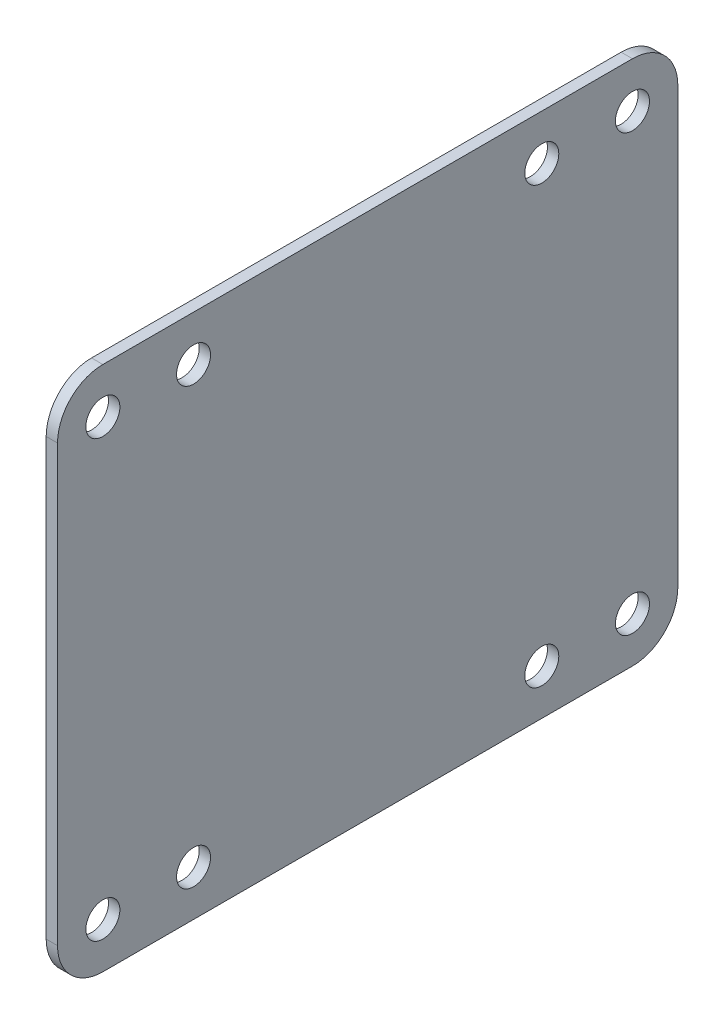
SolidWorks part; units mm, degrees
ref_plane "Front Plane" through (0, 0, 0) normal (0, 0, 1) x (1, 0, 0)
ref_plane "Top Plane" through (0, 0, 0) normal (0, 1, 0) x (1, 0, 0)
ref_plane "Right Plane" through (0, 0, 0) normal (1, 0, 0) x (0, 0, -1)
sketch "Sketch1" plane through (0, 0, 0) normal (1, 0, 0) x (0, 0, -1)
  line L0 (-12.7, 0) -> (61.468, 0) construction
  line L1 (0, 0) -> (48.768, 0) construction
  line L2 (0, 0) -> (0, -60.96) construction
  line L3 (0, -60.96) -> (48.768, -60.96) construction
  line L4 (48.768, 0) -> (48.768, -60.96) construction
  line L5 (-19.05, 6.35) -> (67.818, 6.35)
  line L6 (-19.05, 6.35) -> (-19.05, -67.31)
  line L7 (-19.05, -67.31) -> (67.818, -67.31)
  line L8 (67.818, 6.35) -> (67.818, -67.31)
  line L9 (-12.7, 0) -> (-12.7, -60.96) construction
  line L10 (-12.7, -60.96) -> (61.468, -60.96) construction
  line L11 (61.468, 0) -> (61.468, -60.96) construction
  circle A0 centre (0, 0) radius 2.3813
  circle A1 centre (48.768, 0) radius 2.3812
  circle A2 centre (48.768, -60.96) radius 2.3812
  circle A3 centre (0, -60.96) radius 2.3812
  circle A4 centre (-12.7, 0) radius 2.3813
  circle A5 centre (61.468, 0) radius 2.3812
  circle A6 centre (61.468, -60.96) radius 2.3813
  circle A7 centre (-12.7, -60.96) radius 2.3812
  dimension "D7" = 4.7625
  dimension "D12" = 4.7625
  dimension "D1" = 48.768
  dimension "D2" = 60.96
  dimension "D3" = 6.35
  dimension "D4" = 19.05
  dimension "D5" = 19.05
  dimension "D6" = 6.35
  dimension "D8" = 60.96
  dimension "D9" = 6.35
  dimension "D10" = 6.35
  dimension "D11" = 6.35
extrude "Boss-Extrude1" add sketch "Sketch1" along normal blind 1.5875
fillet "Fillet1" radius 6.35 4 edges at (0.7937, -67.31, 19.05) (0.7937, -67.31, -67.818) (0.7937, 6.35, -67.818) (0.7937, 6.35, 19.05)
